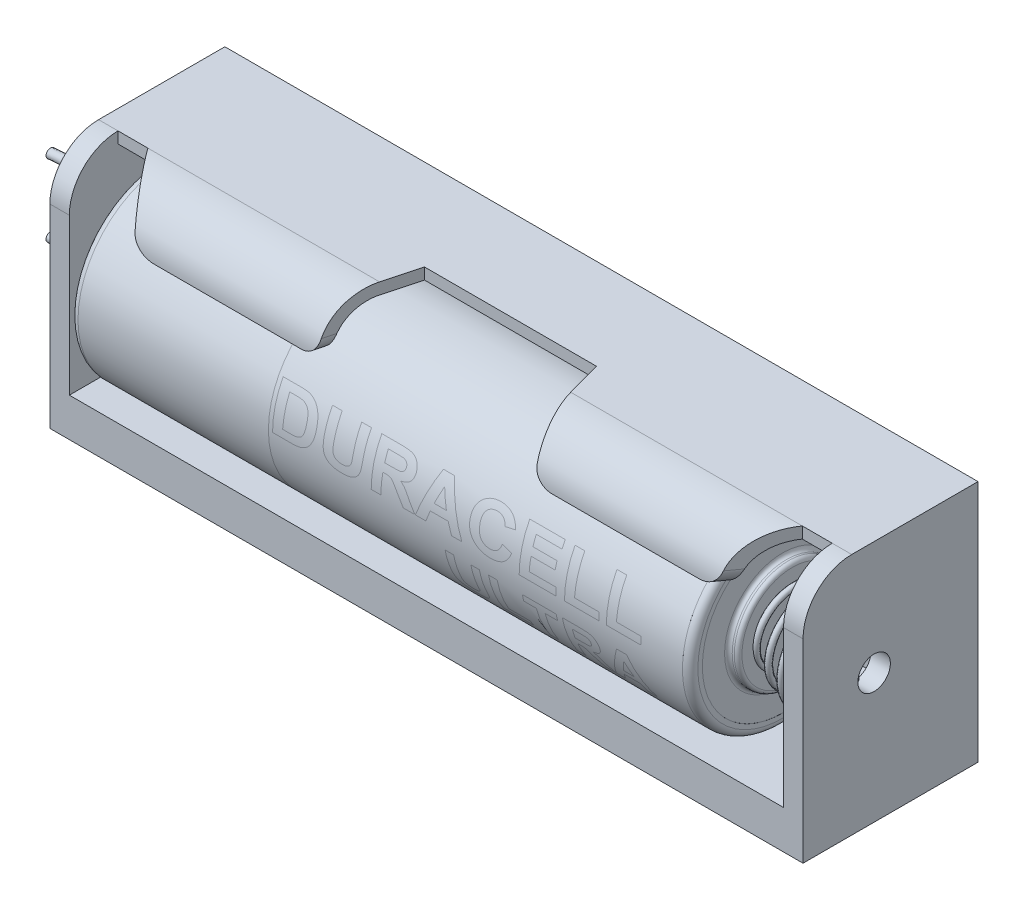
SolidWorks part; units mm, degrees
ref_plane "Front Plane" through (0, 0, 0) normal (0, 0, 1) x (1, 0, 0)
ref_plane "Top Plane" through (0, 0, 0) normal (0, 1, 0) x (1, 0, 0)
ref_plane "Right Plane" through (0, 0, 0) normal (1, 0, 0) x (0, 0, -1)
imported_body "Imported30"
imported_body "Imported31"
imported_body "Imported32"
imported_body "Imported33"
imported_body "Imported34"
imported_body "Imported35"
imported_body "Imported36"
imported_body "Surface-Imported60"
sketch "Sketch1" plane through (0, 0, 13.6906) normal (0, 0, 1) x (1, 0, 0)
  line L0 (-29.464, 12.7) -> (-29.464, -12.7) construction
  line L1 (-29.464, -0.508) -> (29.464, -0.508)
  line L2 (-29.464, -0.508) -> (-29.464, -16.51)
  line L3 (-29.464, -16.51) -> (29.464, -16.51)
  line L4 (29.464, -0.508) -> (29.464, -16.51)
  line L5 (29.464, -16.51) -> (29.464, -12.7) construction
extrude "Extrude1" cut sketch "Sketch1" against normal mid plane 40
sketch "Sketch2" plane through (0, -0.508, 0) normal (0, -1, 0) x (1, 0, 0)
  line L1 (-29.464, 13.6906) -> (29.464, 13.6906)
  line L2 (-29.464, 13.6906) -> (-29.464, 0)
  line L3 (-29.464, 0) -> (29.464, 0)
  line L4 (29.464, 13.6906) -> (29.464, 0)
extrude "Extrude2" add sketch "Sketch2" along normal blind 2
sketch "Sketch3" plane through (0, 0, 0) normal (0, 1, 0) x (1, 0, 0)
  line L1 (-147.9159, 52.4525) -> (-42.7554, 52.4525)
  line L2 (-147.9159, 52.4525) -> (-147.9159, -25.7243)
  line L3 (-147.9159, -25.7243) -> (-42.7554, -25.7243)
  line L4 (-42.7554, 52.4525) -> (-42.7554, -25.7243)
  line L5 (-147.9159, 52.4525) -> (-42.7554, -25.7243) construction
  line L6 (-147.9159, -25.7243) -> (-42.7554, 52.4525) construction
  point P0 (-95.3357, 13.3641)
extrude "Extrude3" cut sketch "Sketch3" against normal mid plane 40
